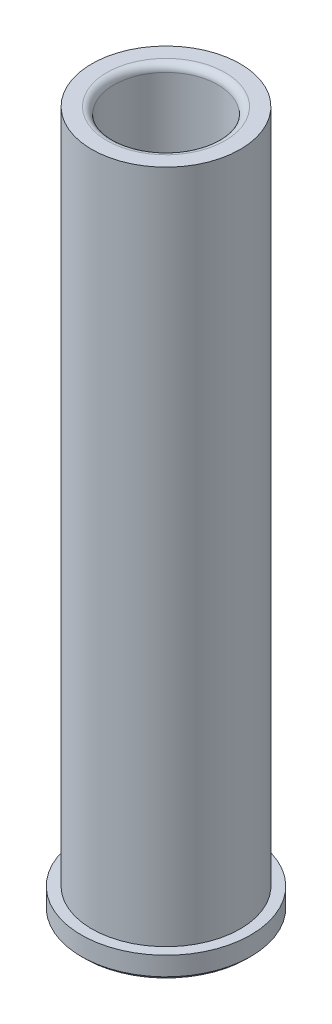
SolidWorks part; units mm, degrees
ref_plane "Front Plane" through (0, 0, 0) normal (0, 0, 1) x (1, 0, 0)
ref_plane "Top Plane" through (0, 0, 0) normal (0, 1, 0) x (1, 0, 0)
ref_plane "Right Plane" through (0, 0, 0) normal (1, 0, 0) x (0, 0, -1)
sketch "Sketch1" plane through (0, 0, 0) normal (0, 0, 1) x (1, 0, 0)
  line L0 (-17.3609, 0) -> (-18.1229, 0.762)
  line L1 (0, -1000) -> (0, 49000) construction
  line L2 (-11.1189, 149.225) -> (-11.1188, 0.762)
  line L3 (-11.8808, 0) -> (-17.3609, 0)
  line L4 (-18.1229, 0.762) -> (-18.1229, 4.7625)
  line L5 (-18.1229, 4.7625) -> (-15.8813, 4.7625)
  line L6 (-15.8814, 149.225) -> (-15.8813, 4.7625)
  line L7 (-15.8814, 149.225) -> (-11.1189, 149.225)
  line L8 (-11.8808, 0) -> (-11.1188, 0.762)
  dimension "OD" = 31.7627
  dimension "ID" = 22.2377
  dimension "H" = 36.2458
  dimension "D2" = 45
  dimension "OVERALL LENGTH" = 149.225
  dimension "D4" = 0.762
  dimension "D5" = 135
  dimension "T" = 4.7625
revolve "Revolve1" add sketch "Sketch1" angle 360 about L1
fillet "Fillet1" radius 1.524 1 edges at (11.1188, 149.225, 0)
